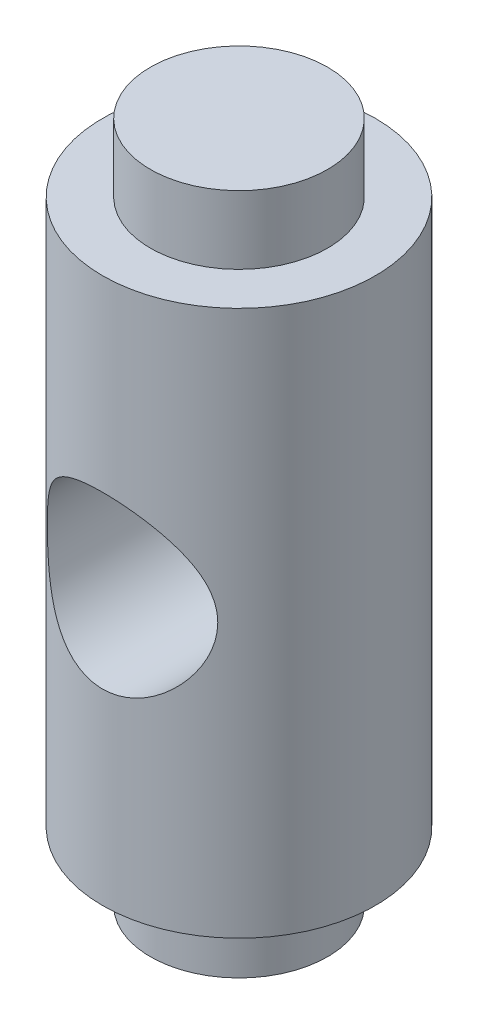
SolidWorks part; units mm, degrees
ref_plane "Front Plane" through (0, 0, 0) normal (0, 0, 1) x (1, 0, 0)
ref_plane "Top Plane" through (0, 0, 0) normal (0, 1, 0) x (1, 0, 0)
ref_plane "Right Plane" through (0, 0, 0) normal (1, 0, 0) x (0, 0, -1)
sketch "Sketch1" plane through (0, 0, 0) normal (0, 0, 1) x (1, 0, 0)
  line L0 (0, 0) -> (0, 25)
  line L1 (0, 25) -> (-6.5, 25)
  line L2 (-6.5, 25) -> (-6.5, 20)
  line L3 (-6.5, 20) -> (-10, 20)
  line L4 (-10, 20) -> (-10, -20)
  line L5 (-10, -20) -> (-6.5, -20)
  line L6 (-6.5, -20) -> (-6.5, -25)
  line L7 (-6.5, -25) -> (0, -25)
  line L8 (0, -25) -> (0, 0)
  dimension "D1" = 10
  dimension "D2" = 25
  dimension "D3" = 5
  dimension "D4" = 6.5
revolve "Revolve1" add sketch "Sketch1" angle 360 about L8
sketch "Sketch2" plane through (0, 0, 0) normal (0, 0, 1) x (1, 0, 0)
  circle A0 centre (0, 0) radius 6
  dimension "D1" = 12
ref_plane "Plane1" through (0, 0, 12) normal (0, 0, 1) x (1, 0, 0)
hole_wizard "M14x1.5 Tapped Hole1" positions "Sketch6" profile "Sketch5" tap size "M14x1.5" standard "ANSI Metric"
sketch "Sketch6" plane through (0, 0, 12) normal (0, 0, 1) x (1, 0, 0)
  point P0 (0, 0)
sketch "Sketch5" plane through (0, 0, 12) normal (1, 0, 0) x (0, -1, 0)
  line L0 (0, 0) -> (0, 36.2554)
  line L1 (0, 36.2554) -> (6.25, 32.5)
  line L2 (6.25, 32.5) -> (6.25, 0)
  line L5 (6.25, 0) -> (0, 0)
  line L10 (0, 36.2554) -> (-6.25, 32.5) construction
  line L11 (0, -6.35) -> (0, 107.95) construction
  dimension "Tap Drill Dia." = 12.5
  dimension "Tap Drill Depth" = 32.5
  dimension "Drill Angle" = 118
